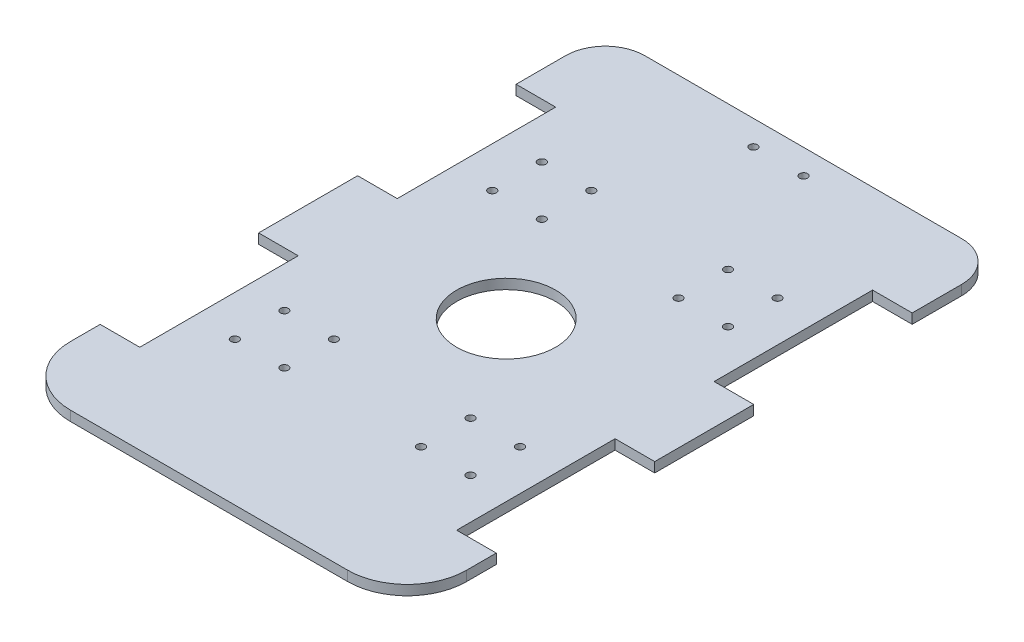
SolidWorks part; units mm, degrees
ref_plane "Front" through (0, 0, 0) normal (0, 0, 1) x (1, 0, 0)
ref_plane "Top" through (0, 0, 0) normal (0, 1, 0) x (1, 0, 0)
ref_plane "Right" through (0, 0, 0) normal (1, 0, 0) x (0, 0, -1)
sketch "Sketch1" plane through (0, 0, 0) normal (0, 1, 0) x (1, 0, 0)
  line L0 (0, 179.8705) -> (0, -170.2797) construction
  line L1 (-80, 150) -> (80, 150)
  line L2 (-100, 130) -> (-100, 105)
  line L3 (-70, -150) -> (70, -150)
  line L4 (100, 130) -> (100, 105)
  line L5 (-100, 150) -> (100, -150) construction
  line L6 (-100, -150) -> (100, 150) construction
  line L7 (-80, -105) -> (-100, -105)
  line L8 (80, -25) -> (100, -25)
  line L9 (80, -25) -> (80, -105)
  line L10 (80, -105) -> (100, -105)
  line L12 (80, 105) -> (100, 105)
  line L13 (80, 105) -> (80, 25)
  line L14 (80, 25) -> (100, 25)
  line L17 (-80, -25) -> (-100, -25)
  line L18 (-80, -25) -> (-80, -105)
  line L19 (-67.5, 50.5) -> (-33.5, 50.5) construction
  line L20 (-80, 25) -> (-100, 25)
  line L22 (-80, 105) -> (-100, 105)
  line L23 (-80, 105) -> (-80, 25)
  line L24 (100, 25) -> (100, -25)
  line L25 (100, -105) -> (100, -120)
  line L26 (-100, -105) -> (-100, -120)
  line L27 (-34.5, 52.5) -> (-59.5, 52.5) construction
  line L28 (-100, 25) -> (-100, -25)
  line L29 (-34.5, 52.5) -> (-34.5, 77.5) construction
  line L30 (-34.5, 77.5) -> (-59.5, 77.5) construction
  line L31 (-59.5, 52.5) -> (-59.5, 77.5) construction
  line L32 (-33.5, 54.5) -> (-67.5, 54.5) construction
  line L33 (-33.5, 79.5) -> (-67.5, 79.5) construction
  line L34 (-67.5, 75.5) -> (-33.5, 75.5) construction
  line L35 (115.1039, 0) -> (-141.1607, 0) construction
  line L36 (59.5, 52.5) -> (59.5, 77.5) construction
  line L37 (34.5, 52.5) -> (34.5, 77.5) construction
  arc A0 (100, -120) -> (70, -150) centre (70, -120) cw
  arc A1 (-100, -120) -> (-70, -150) centre (-70, -120) ccw
  arc A2 (80, 150) -> (100, 130) centre (80, 130) cw
  arc A3 (-80, 150) -> (-100, 130) centre (-80, 130) ccw
  circle A4 centre (0, 0) radius 25
  arc A5 (-33.5, 50.5) -> (-33.5, 54.5) centre (-33.5, 52.5) ccw construction
  circle A6 centre (-34.5, 52.5) radius 2
  circle A7 centre (-59.5, 52.5) radius 2
  circle A8 centre (-59.5, 77.5) radius 2
  circle A9 centre (-34.5, 77.5) radius 2
  circle A10 centre (-59.5, -77.5) radius 2
  circle A11 centre (-59.5, -52.5) radius 2
  circle A12 centre (-34.5, -52.5) radius 2
  circle A13 centre (-34.5, -77.5) radius 2
  circle A14 centre (59.5, 77.5) radius 2
  circle A15 centre (59.5, 52.5) radius 2
  circle A16 centre (34.5, 77.5) radius 2
  circle A17 centre (34.5, 52.5) radius 2
  circle A18 centre (59.5, -52.5) radius 2
  circle A19 centre (59.5, -77.5) radius 2
  circle A20 centre (34.5, -52.5) radius 2
  circle A21 centre (34.5, -77.5) radius 2
  circle A22 centre (12.6568, 137.4974) radius 2
  circle A23 centre (-12.6568, 137.4974) radius 2
  point P0 (0, 0)
  point P87 (0, 0)
  point P88 (0, 0)
  point P89 (-12.6568, 137.4974)
  dimension "D3" = 30
  dimension "D4" = 20
  dimension "D5" = 50
  dimension "D12" = 4
  dimension "D13" = 4
  dimension "D1" = 300
  dimension "D2" = 200
  dimension "D6" = 80
  dimension "D7" = 45
  dimension "D8" = 50
  dimension "D9" = 25
  dimension "D10" = 20
  dimension "D11" = 1
extrude "Boss-Extrude1" add sketch "Sketch1" along normal blind 5
